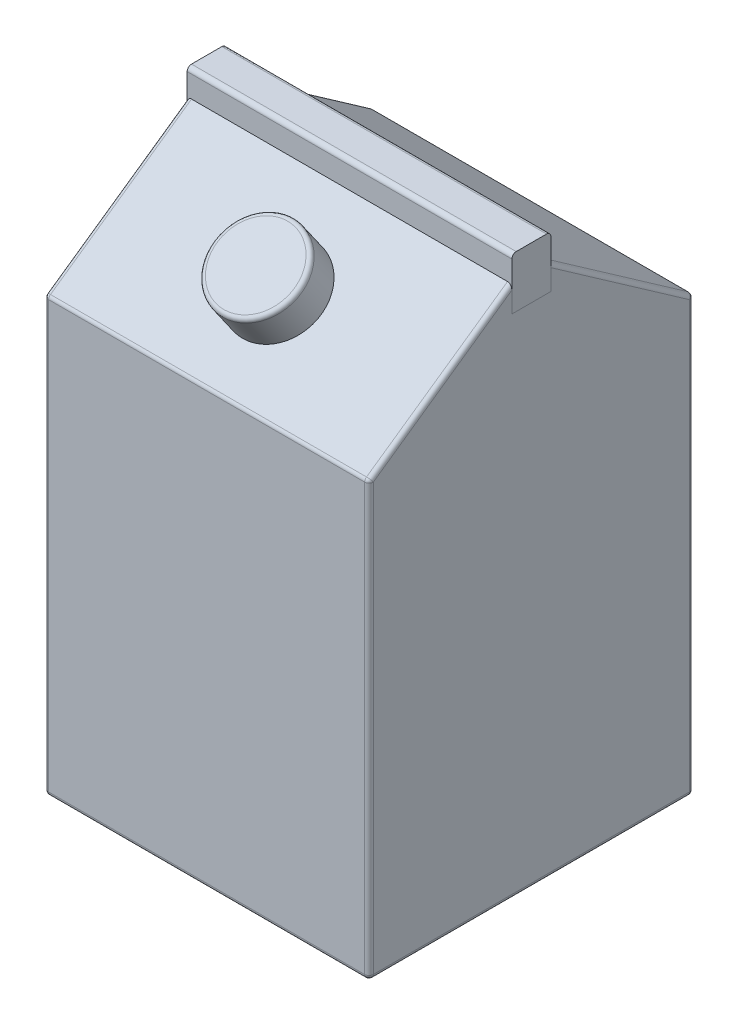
SolidWorks part; units mm, degrees
ref_plane "Front Plane" through (0, 0, 0) normal (0, 0, 1) x (1, 0, 0)
ref_plane "Top Plane" through (0, 0, 0) normal (0, 1, 0) x (1, 0, 0)
ref_plane "Right Plane" through (0, 0, 0) normal (1, 0, 0) x (0, 0, -1)
sketch "Sketch4" plane through (0, 0, 0) normal (1, 0, 0) x (0, 0, -1)
  line L0 (-37.5, 100) -> (-4.5, 123.1068)
  line L2 (-37.5, 100) -> (-37.5, 0)
  line L3 (-37.5, 0) -> (37.5, 0)
  line L4 (37.5, 100) -> (37.5, 0)
  line L5 (-4.5, 123.1068) -> (-4.5, 117.1068)
  line L6 (-4.5, 117.1068) -> (4.5, 117.1068)
  line L7 (4.5, 117.1068) -> (4.5, 123.1068)
  line L8 (4.5, 123.1068) -> (37.5, 100)
  point P4 (0, 0)
  dimension "D1" = 100
  dimension "D2" = 75
  dimension "D3" = 9
  dimension "D4" = 6
  dimension "D5" = 125
extrude "Boss-Extrude2" add sketch "Sketch4" along normal mid plane 75
sketch "Sketch5" plane through (0, 117.1068, 0) normal (0, 1, 0) x (1, 0, 0)
  line L4 (-37.5, 4.5) -> (-37.5, -4.5)
  line L5 (-37.5, -4.5) -> (37.5, -4.5)
  line L6 (37.5, -4.5) -> (37.5, 4.5)
  line L7 (37.5, 4.5) -> (-37.5, 4.5)
  line L8 (-37.5, 4.5) -> (-37.5, -4.5)
  line L9 (-37.5, -4.5) -> (37.5, -4.5)
  line L10 (37.5, -4.5) -> (37.5, 4.5)
  line L11 (37.5, 4.5) -> (-37.5, 4.5)
  dimension "D1" = 0
extrude "Boss-Extrude3" add sketch "Sketch5" along normal blind 12 separate body
sketch "Sketch6" plane through (0, 84.7202, 59.3218) normal (0, 0.8192, 0.5736) x (1, 0, 0)
  line L0 (-37.5, 66.925) -> (-37.5, 26.6394) construction
  circle A0 centre (0, 46.7822) radius 10
  point P6 (-37.5, 46.7822)
  dimension "D1" = 20
extrude "Boss-Extrude4" add sketch "Sketch6" along normal blind 9 separate body
fillet "Fillet1" radius 1 1 edges at (0, 113.19, 34.3537)
fillet "Fillet2" radius 1 14 edges at (0, 0, 37.5) (37.5, 0, 0) (0, 0, -37.5) (-37.5, 0, 0) (-37.5, 50, -37.5) (-37.5, 111.5534, -21) (0, 100, 37.5) (0, 100, -37.5) (37.5, 50, -37.5) (37.5, 111.5534, -21) (-37.5, 111.5534, 21) (-37.5, 50, 37.5) (37.5, 111.5534, 21) (37.5, 50, 37.5)
fillet "Fillet3" radius 1 2 edges at (0, 129.1068, -4.5) (0, 129.1068, 4.5)
